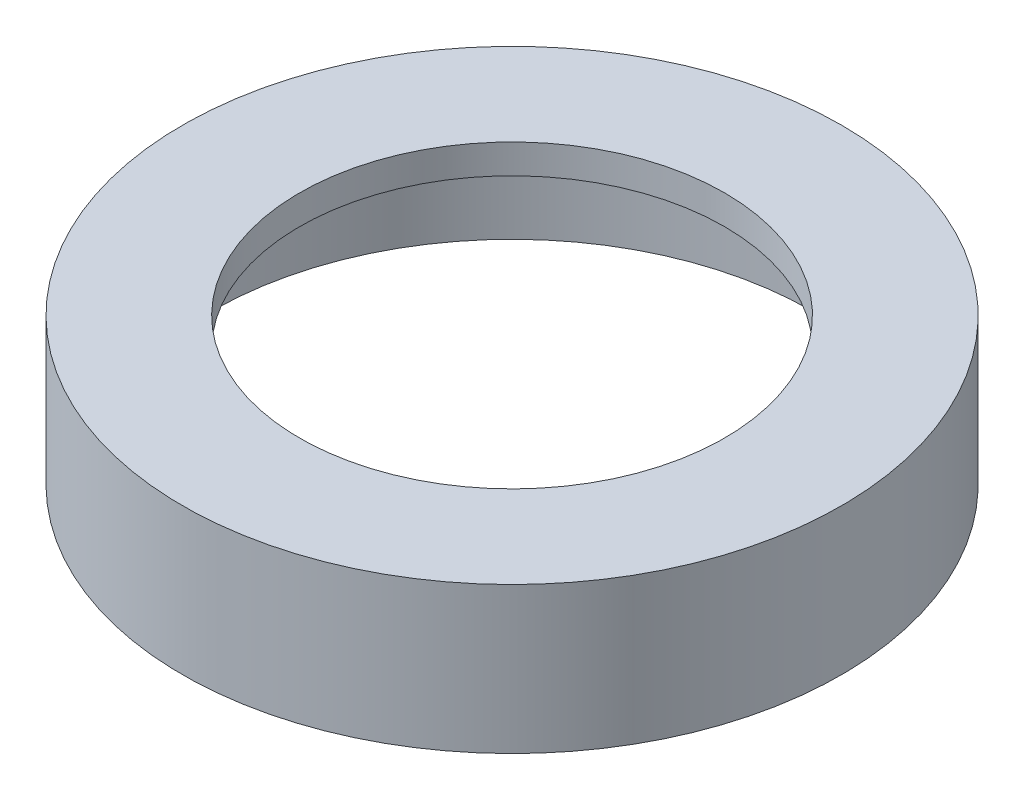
SolidWorks part; units mm, degrees
ref_plane "Front" through (0, 0, 0) normal (0, 0, 1) x (1, 0, 0)
ref_plane "Top" through (0, 0, 0) normal (0, 1, 0) x (1, 0, 0)
ref_plane "Right" through (0, 0, 0) normal (1, 0, 0) x (0, 0, -1)
sketch "Sketch1" plane through (0, 0, 0) normal (0, 0, 1) x (1, 0, 0)
  line L0 (-32.5628, 120.65) -> (-32.5628, 133.35)
  line L1 (-32.5628, 133.35) -> (-23.0378, 133.35)
  line L2 (34.925, 133.35) -> (-28.575, 133.35) construction
  line L3 (-23.0378, 133.35) -> (-23.0378, 136.525)
  line L4 (-23.0378, 136.525) -> (-35.7378, 136.525)
  line L5 (-35.7378, 136.525) -> (-35.7378, 120.65)
  line L6 (-35.7378, 120.65) -> (-32.5628, 120.65)
  line L7 (0, 0) -> (0, 150.4847) construction
  dimension "D1" = 65.1256
  dimension "D2" = 12.7
  dimension "D3" = 3.175
  dimension "D4" = 12.7
  dimension "D5" = 120.65
revolve "Revolve1" add sketch "Sketch1" angle 360 about L7
